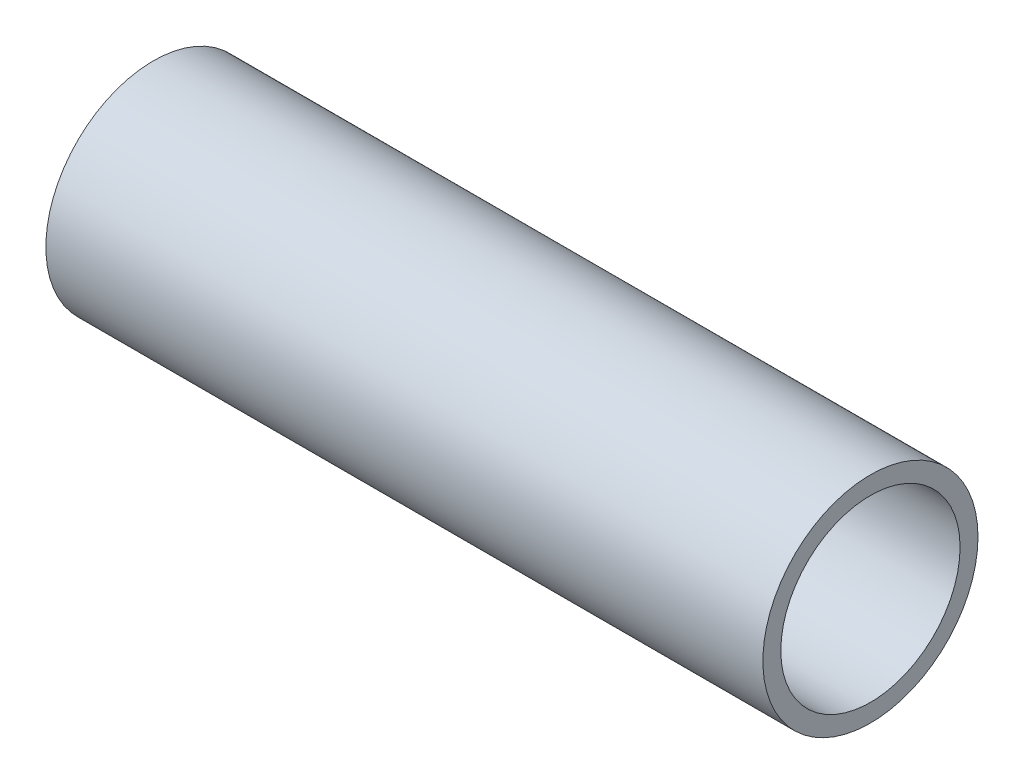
SolidWorks part; units mm, degrees
ref_plane "Front Plane" through (0, 0, 0) normal (0, 0, 1) x (1, 0, 0)
ref_plane "Top Plane" through (0, 0, 0) normal (0, 1, 0) x (1, 0, 0)
ref_plane "Right Plane" through (0, 0, 0) normal (1, 0, 0) x (0, 0, -1)
sketch "Sketch1" plane through (0, 0, 0) normal (1, 0, 0) x (0, 0, -1)
  circle A0 centre (0, 0) radius 50
  circle A1 centre (0, 0) radius 60
  dimension "D1" = 100
  dimension "D2" = 120
extrude "Boss-Extrude1" add sketch "Sketch1" along normal blind 400
sketch "Sketch2" plane through (0, 0, 0) normal (0, 0, 1) x (1, 0, 0)
  line L0 (0, 0) -> (200, 0) construction
  circle A0 centre (200, 0) radius 40
  dimension "D2" = 80
  dimension "D1" = 200
extrude "Cut-Extrude1" cut sketch "Sketch2" against normal blind 400
